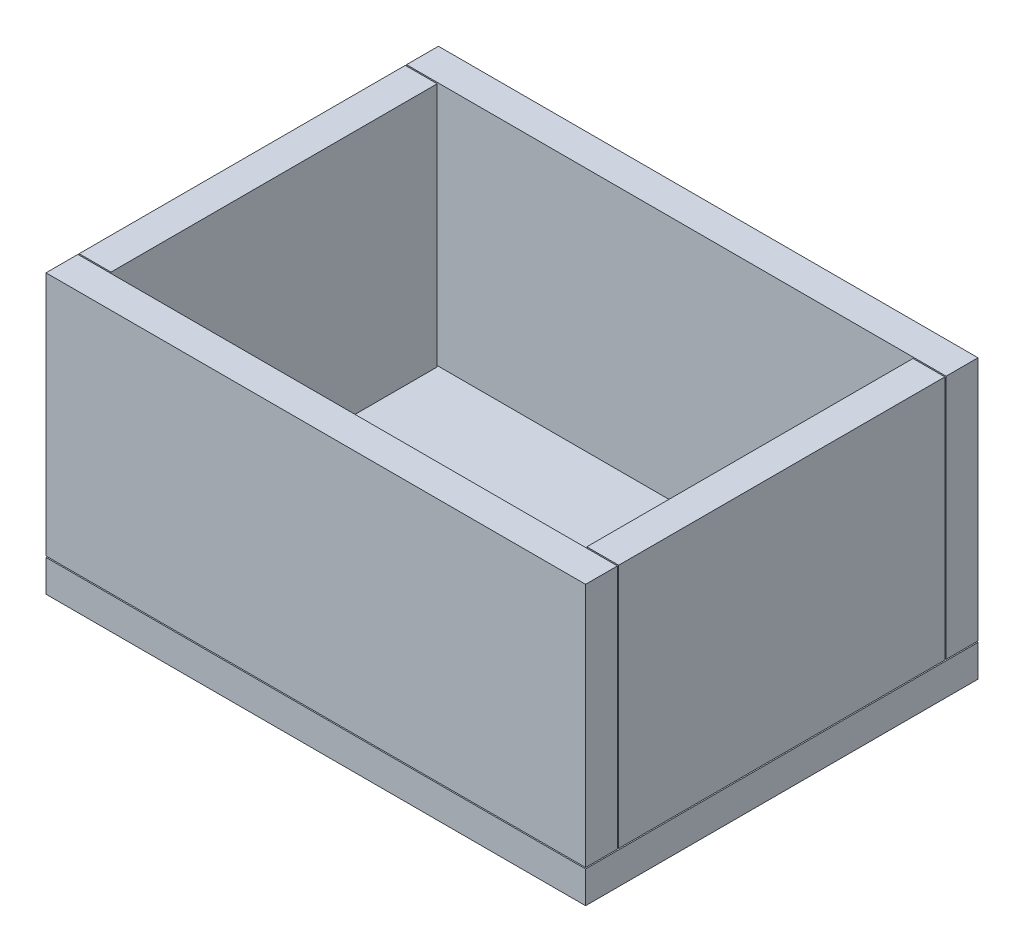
SolidWorks part; units mm, degrees
ref_plane "Front Plane" through (0, 0, 0) normal (0, 0, 1) x (1, 0, 0)
ref_plane "Top Plane" through (0, 0, 0) normal (0, 1, 0) x (1, 0, 0)
ref_plane "Right Plane" through (0, 0, 0) normal (1, 0, 0) x (0, 0, -1)
sketch "Sketch1" plane through (0, 0, 0) normal (0, 1, 0) x (1, 0, 0)
  line L0 (600, -382.5) -> (-600, 382.5) construction
  line L1 (-600, -382.5) -> (600, -382.5) construction
  line L2 (-600, -382.5) -> (-600, 382.5) construction
  line L3 (-600, 382.5) -> (600, 382.5) construction
  line L4 (600, -382.5) -> (600, 382.5) construction
  point P4 (0, 0)
  point P5 (-394.3002, -185.9969)
  dimension "D1" = 1200
  dimension "D2" = 765
sketch "Sketch2" plane through (0, 0, 0) normal (0, 1, 0) x (1, 0, 0)
  line L0 (-110, -80) -> (110, 80) construction
  line L1 (-110, 80) -> (110, 80)
  line L2 (-110, 80) -> (-110, -80)
  line L3 (-110, -80) -> (110, -80)
  line L4 (110, 80) -> (110, -80)
  dimension "D1" = 220
  dimension "D2" = 160
extrude "Boss-Extrude1" add sketch "Sketch2" along normal blind 13
sketch "Sketch3" plane through (0, 13, 0) normal (0, 1, 0) x (1, 0, 0)
  line L0 (110, -80) -> (110, 80) construction
  line L1 (-110, 80) -> (110, 80)
  line L2 (-110, 80) -> (-110, 67)
  line L3 (-110, 67) -> (110, 67)
  line L4 (110, 80) -> (110, 67)
  line L6 (-110, -80) -> (110, -80)
  line L7 (-110, -80) -> (-110, -67)
  line L8 (-110, -67) -> (110, -67)
  line L9 (110, -80) -> (110, -67)
  dimension "D1" = 13
extrude "Boss-Extrude3" add sketch "Sketch3" along normal blind 100 from offset 0.5 separate body
sketch "Sketch4" plane through (0, 13, 0) normal (0, 1, 0) x (1, 0, 0)
  line L0 (-110, 80) -> (-110, -80) construction
  line L1 (-110, 66.5) -> (-97, 66.5)
  line L2 (-110, 66.5) -> (-110, -66.5)
  line L3 (-110, -66.5) -> (-97, -66.5)
  line L4 (-97, 66.5) -> (-97, -66.5)
  line L5 (-110, 67) -> (110, 67) construction
  line L6 (110, -67) -> (-110, -67) construction
  line L7 (110, -80) -> (110, 80) construction
  line L8 (110, 66.5) -> (97, 66.5)
  line L9 (110, 66.5) -> (110, -66.5)
  line L10 (110, -66.5) -> (97, -66.5)
  line L11 (97, 66.5) -> (97, -66.5)
  dimension "D1" = 0.5
  dimension "D2" = 0.5
  dimension "D3" = 13
  dimension "D4" = 13
extrude "Boss-Extrude4" add sketch "Sketch4" along normal up to surface (100 mm away) from offset 0.5 separate body
